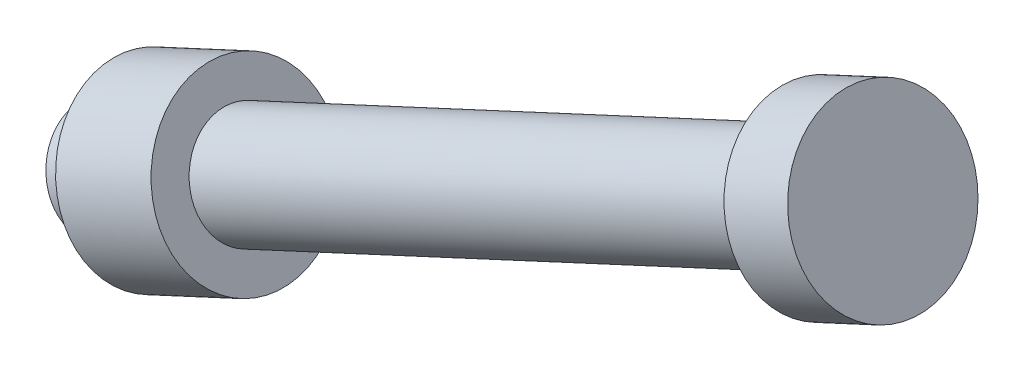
SolidWorks part; units mm, degrees
ref_plane "Alzado" through (0, 0, 0) normal (0, 0, 1) x (1, 0, 0)
ref_plane "Planta" through (0, 0, 0) normal (0, 1, 0) x (1, 0, 0)
ref_plane "Vista lateral" through (0, 0, 0) normal (1, 0, 0) x (0, 0, -1)
sketch3d "Sk_Cabeza"
  line L0 (436.5934, 392.8864, 0) -> (440.2217, 394.5702, 0)
  dimension "D1" = 4
sweep "Cabeza" add path "Sk_Cabeza" parameters "D3"=10
sketch3d "Sk_Vastago"
  line L0 (395.775, 373.9428, 0) -> (436.5934, 392.8864, 0)
  dimension "D1" = 45
sweep "Vastago" add path "Sk_Vastago" parameters "D3"=6
sketch3d "Sk_Tuerca"
  line L0 (398.4962, 375.2057, 0) -> (403.9387, 377.7315, 0)
  dimension "D1" = 6
sweep "Tuerca" add path "Sk_Tuerca" parameters "D3"=10
sketch "Croquis23" plane through (468.4281, 217.3947, 0) normal (-0.9071, -0.421, 0) x (0, 0, 1)
  circle A0 centre (0, 172.5855) radius 3
  circle A1 centre (0, 172.5855) radius 3
curve "Hélice/Espiral1"
